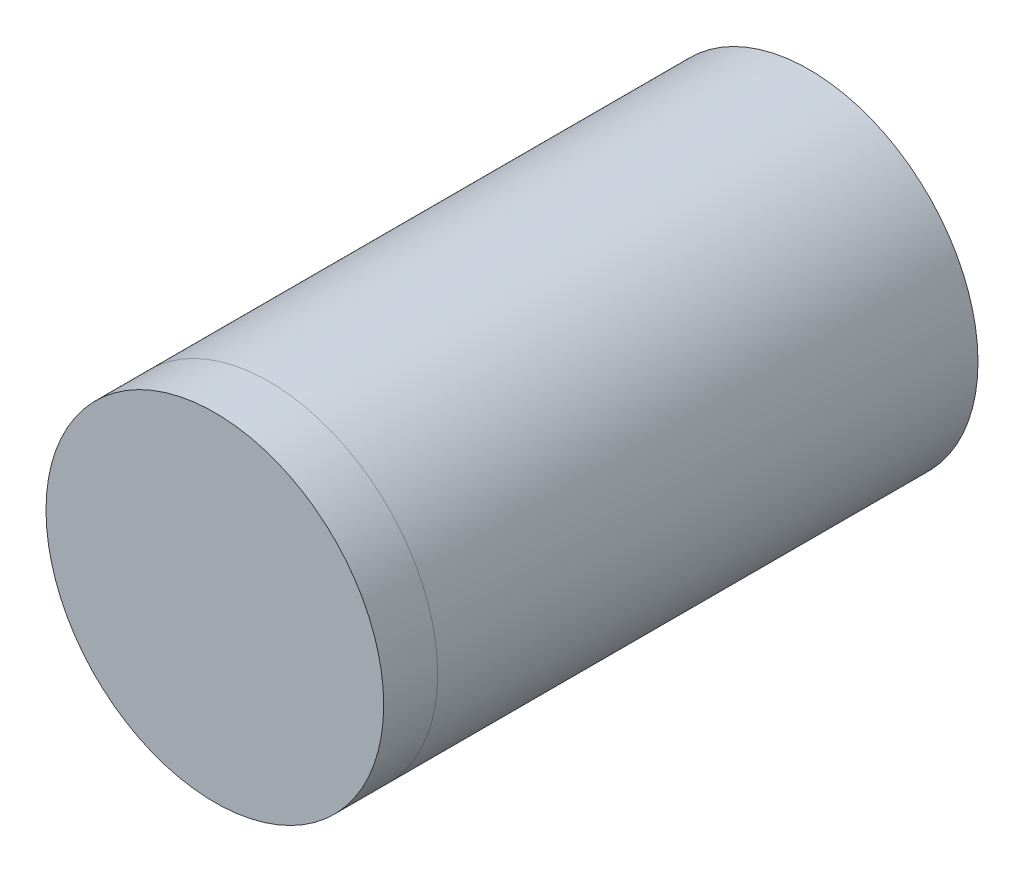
SolidWorks part; units mm, degrees
ref_plane "Plan1" through (0, 0, 0) normal (0, 0, 1) x (1, 0, 0)
ref_plane "Plan2" through (0, 0, 0) normal (0, 1, 0) x (1, 0, 0)
ref_plane "Plan3" through (0, 0, 0) normal (1, 0, 0) x (0, 0, -1)
sketch "EsquisseCorps" plane through (0, 0, 0) normal (0, 1, 0) x (1, 0, 0)
  line L0 (0, 0) -> (0, -35.199) construction
  line L1 (0, -31.999) -> (10.0005, -31.999)
  line L2 (0, -31.999) -> (0, -35.199)
  line L3 (0, -35.199) -> (10.0005, -35.199)
  line L4 (10.0005, -31.999) -> (10.0005, -35.199)
  dimension "LongueurHorsBroche" = 35.199
  dimension "LongueurCorps" = 3.2
  dimension "RayonCorps" = 10.0005
revolve "Base-Révolution" add sketch "EsquisseCorps" angle 360 about L0
sketch "Esquisse1" plane through (0, 0, 0) normal (0, 1, 0) x (1, 0, 0)
  line L0 (0, 0.001) -> (0, -31.999) construction
  line L1 (0, 0.001) -> (10, 0.001)
  line L2 (0, 0.001) -> (0, -31.999)
  line L3 (0, -31.999) -> (10, -31.999)
  line L4 (10, 0.001) -> (10, -31.999)
  line L5 (0, 12.3484) -> (0, -19.1197) construction
  dimension "Rayon" = 10
  dimension "LongueurUtile" = 32
  dimension "SurLongueur" = 0.001
revolve "Boss.-Révol.1" add sketch "Esquisse1" angle 360 about L0
sketch "Esquisse2" [suppressed] plane through (0, 0, 0) normal (0, 1, 0) x (1, 0, 0)
  line L0 (0, -12) -> (0, 7.4067)
  line L2 (20, -12) -> (0, -12)
  line L3 (0, 0) -> (0, -20) construction
  line L4 (0, 7.4067) -> (5.8225, 7.4067)
  line L5 (20, -10) -> (20, -12)
  line L6 (0, 0) -> (0, -12) construction
  line L7 (5.8225, 7.4067) -> (20, -10)
  dimension "LongueurUtile" = 19.4067
  dimension "Rayon2" = 20
  dimension "Rayon1" = 5.8225
  dimension "SurLongueur" = 7.4067
  dimension "LongueurCyl" = 2
revolve "Boss.-Révol.2" [suppressed] add sketch "Esquisse2" angle 360 about L6
sketch "Esquisse3" [suppressed] plane through (0, 0, 0) normal (0, 1, 0) x (1, 0, 0)
  line L0 (15, -10.438) -> (15, -14.0265)
  line L1 (0, 0) -> (0, -20) construction
  line L2 (0, 4.562) -> (0, -14.0265)
  line L3 (0, -14.0265) -> (15, -14.0265)
  line L4 (0, 4.562) -> (0, -14.0265) construction
  arc A0 (15, -10.438) -> (0, 4.562) centre (0, -10.438) ccw
  dimension "LongueurUtile" = 18.5885
  dimension "Rayon1" = 15
  dimension "SurLongueur" = 4.562
revolve "Boss.-Révol.3" [suppressed] add sketch "Esquisse3" angle 360 about L4
sketch "Esquisse4" [suppressed] plane through (0, 0, 0) normal (0, 1, 0) x (1, 0, 0)
  line L0 (0, -11.9602) -> (0, 1.9611)
  line L1 (0, 1.9611) -> (10.7931, 1.9611)
  line L2 (0, -11.9602) -> (10.7931, -11.9602)
  line L5 (0, 0) -> (0, -12.8248) construction
  arc A0 (10.7931, 1.9611) -> (10.7931, -11.9602) centre (10.7931, -4.9996) cw
  dimension "Rayon2" = 6.9606
  dimension "Rayon1" = 10.7931
  dimension "SurLongueur" = 1.9611
revolve "Boss.-Révol.4" [suppressed] add sketch "Esquisse4" angle 360 about L5
sketch "Esquisse5" [suppressed] plane through (0, 0, 0) normal (0, 1, 0) x (1, 0, 0)
  line L0 (0, 0) -> (0, -15.295)
  line L1 (0, 0) -> (0, -20) construction
  line L2 (0, 0) -> (6.1156, 0)
  line L3 (0, -15.295) -> (11.1156, -15.295)
  line L4 (11.1156, -15.295) -> (11.1156, -5)
  line L5 (0, -15.295) -> (0, 0) construction
  arc A0 (11.1156, -5) -> (6.1156, 0) centre (6.1156, -5) ccw
  dimension "Rayon2" = 5
  dimension "LongueurUtile" = 15.295
  dimension "Rayon1" = 11.1156
revolve "Boss.-Révol.5" [suppressed] add sketch "Esquisse5" angle 360 about L5
sketch "Esquisse6" [suppressed] plane through (0, 0, 0) normal (0, 1, 0) x (1, 0, 0)
  line L0 (0, -12.8875) -> (0, 5.1125)
  line L1 (0, 5.1125) -> (10.2661, 5.1125)
  line L2 (16.689, -3.8875) -> (10.2661, -12.8875)
  line L3 (10.2661, -12.8875) -> (0, -12.8875)
  line L4 (10.2661, 5.1125) -> (16.689, -3.8875)
  line L5 (0, 0) -> (0, -12.8875) construction
  dimension "LongueurUtile" = 18
  dimension "Rayon1" = 16.689
  dimension "Rayon2" = 10.2661
  dimension "DemiLongueur" = 9
  dimension "SurLongueur" = 5.1125
  dimension "Rayon3" = 10.2661
revolve "Boss.-Révol.6" [suppressed] add sketch "Esquisse6" angle 360 about L5
sketch "Esquisse7" [suppressed] plane through (0, 0, 0) normal (0, 1, 0) x (1, 0, 0)
  line L0 (0, 0) -> (2.1898, -1.2643)
  line L1 (2.1898, -1.2643) -> (2.1898, -3.8966)
  line L2 (2.1898, -3.8966) -> (7.0523, -12.3186)
  line L3 (0, 0) -> (0, -15.8125)
  line L4 (0, 0) -> (0, -20) construction
  line L5 (0, -10) -> (0, -20) construction
  line L6 (0, 0) -> (0, -15.8125) construction
  line L7 (0, -15.8125) -> (7.0523, -15.8125)
  line L8 (7.0523, -15.8125) -> (7.0523, -12.3186)
  dimension "Angle1" = 60
  dimension "Angle2" = 30
  dimension "LongueurUtile" = 15.8125
  dimension "Rayon2" = 2.1898
  dimension "Rayon1" = 7.0523
  dimension "LongueurCyl" = 3.4939
revolve "Boss.-Révol.7" [suppressed] add sketch "Esquisse7" angle 360 about L6
sketch "EsquisseADCYL" [suppressed] plane through (0, 0, 0) normal (0, 1, 0) x (1, 0, 0)
  line L0 (0, -19.99) -> (12.5, -19.99)
  line L1 (0, 0) -> (0, -55) construction
  line L2 (12.5, -19.99) -> (12.5, -35)
  line L3 (12.5, -35) -> (15, -35)
  line L4 (15, -35) -> (15, -45)
  line L5 (15, -45) -> (0, -45)
  line L6 (0, -45) -> (0, -19.99)
  line L7 (0, 0) -> (0, -45) construction
  dimension "Longueur1" = 15.01
  dimension "Longueur2" = 10
  dimension "Rayon1" = 12.5
  dimension "Rayon2" = 15
  dimension "Position" = 19.99
revolve "Adaptateur-Cylindrique" [suppressed] add sketch "EsquisseADCYL" angle 360 about L7
sketch "EsquisseADCONE" [suppressed] plane through (0, 0, 0) normal (0, 1, 0) x (1, 0, 0)
  line L0 (0, -19.99) -> (12.5, -19.99)
  line L1 (0, 0) -> (0, -55) construction
  line L2 (12.5, -19.99) -> (15, -35)
  line L3 (15, -35) -> (15, -45)
  line L4 (15, -45) -> (0, -45)
  line L5 (0, -45) -> (0, -19.99)
  line L6 (0, 0) -> (0, -45) construction
  dimension "Rayon1" = 12.5
  dimension "Rayon2" = 15
  dimension "Longueur2" = 10
  dimension "Longueur1" = 15.01
  dimension "Position" = 19.99
revolve "Adaptateur-Conique" [suppressed] add sketch "EsquisseADCONE" angle 360 about L6
sketch "EsquisseATCYL" [suppressed] plane through (0, 0, 0) normal (0, 1, 0) x (1, 0, 0)
  line L0 (0, -44.9) -> (20, -44.9)
  line L1 (0, 0) -> (0, -55) construction
  line L2 (20, -44.9) -> (20, -64.91)
  line L3 (20, -64.91) -> (25, -64.91)
  line L4 (25, -64.91) -> (25, -84.91)
  line L5 (25, -84.91) -> (0, -84.91)
  line L6 (0, -84.91) -> (0, -44.9)
  line L7 (0, -84.91) -> (0, 0) construction
  dimension "Rayon1" = 20
  dimension "Rayon2" = 25
  dimension "Longueur1" = 20.01
  dimension "Longueur2" = 20
  dimension "Position" = 44.9
revolve "Attachement-Cylindrique" [suppressed] add sketch "EsquisseATCYL" angle 360 about L7
sketch "EsquisseATCONE" [suppressed] plane through (0, 0, 0) normal (0, 1, 0) x (1, 0, 0)
  line L0 (0, -24.3219) -> (7.3421, -24.3219)
  line L1 (0, 0) -> (0, -55) construction
  line L2 (7.3421, -24.3219) -> (13.3823, -31.8202)
  line L3 (13.3823, -31.8202) -> (13.3823, -41.193)
  line L4 (13.3823, -41.193) -> (0, -41.193)
  line L5 (0, -41.193) -> (0, -24.3219)
  line L6 (0, -41.193) -> (0, 0) construction
  dimension "Rayon1" = 7.3421
  dimension "Rayon2" = 13.3823
  dimension "Longueur1" = 7.4983
  dimension "Longueur2" = 9.3728
  dimension "Position" = 24.3219
revolve "Attachement-Conique" [suppressed] add sketch "EsquisseATCONE" angle 360 about L6
